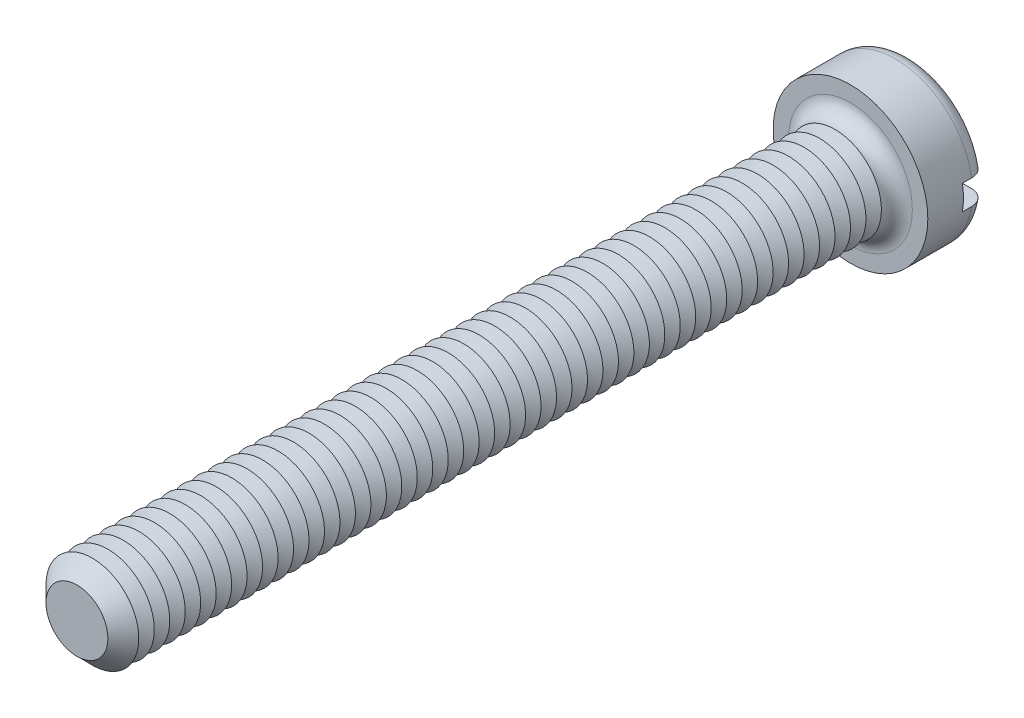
SolidWorks part; units mm, degrees
ref_plane "Front Plane" through (0, 0, 0) normal (0, 0, 1) x (1, 0, 0)
ref_plane "Top Plane" through (0, 0, 0) normal (0, 1, 0) x (1, 0, 0)
ref_plane "Right Plane" through (0, 0, 0) normal (1, 0, 0) x (0, 0, -1)
sketch "Sketch3" plane through (0, 0, 0) normal (0, 0, 1) x (1, 0, 0)
  circle A0 centre (0, 0) radius 5
  dimension "D1" = 10
extrude "Boss-Extrude2" add sketch "Sketch3" against normal blind 3.9
sketch "Sketch4" plane through (0, 0, 0) normal (0, 0, 1) x (1, 0, 0)
  circle A0 centre (0, 0) radius 3
  dimension "D1" = 6
extrude "Boss-Extrude3" add sketch "Sketch4" along normal blind 50
fillet "Fillet1" radius 1 2 edges at (5, 0, -3.9) (3, 0, 0)
chamfer "Chamfer1" distance 1 angle 45 1 edges at (3, 0, 50)
sketch "Sketch5" plane through (0, 0, 0) normal (1, 0, 0) x (0, 0, -1)
  line L0 (1.6944, 0) -> (-7.6738, 0) construction
sketch "Sketch6" plane through (0, 0, 0) normal (1, 0, 0) x (0, 0, -1)
  line L0 (-1, 3) -> (-1.5, 2.134)
  line L1 (-1.5, 2.134) -> (-2, 3)
  line L2 (-1, 3) -> (-49, 3) construction
  line L3 (-2, 3) -> (-1, 3)
  dimension "D1" = 1
revolve "Cut-Revolve1" cut sketch "Sketch6" angle 360 about L0
pattern_linear "LPattern1" count 48 spacing 1 along (0, 0, 1) of "Cut-Revolve1"
sketch "Sketch8" plane through (0, 0, -3.9) normal (0, 0, -1) x (-1, 0, 0)
  line L1 (5, -0.8) -> (-5, -0.8)
  line L2 (5, -0.8) -> (5, 0.8)
  line L3 (5, 0.8) -> (-5, 0.8)
  line L4 (-5, -0.8) -> (-5, 0.8)
  line L5 (5, -0.8) -> (-5, 0.8) construction
  line L6 (5, 0.8) -> (-5, -0.8) construction
  point P0 (0, 0)
  dimension "D1" = 10
  dimension "D2" = 1.6
extrude "Cut-Extrude1" cut sketch "Sketch8" against normal blind 1.6
